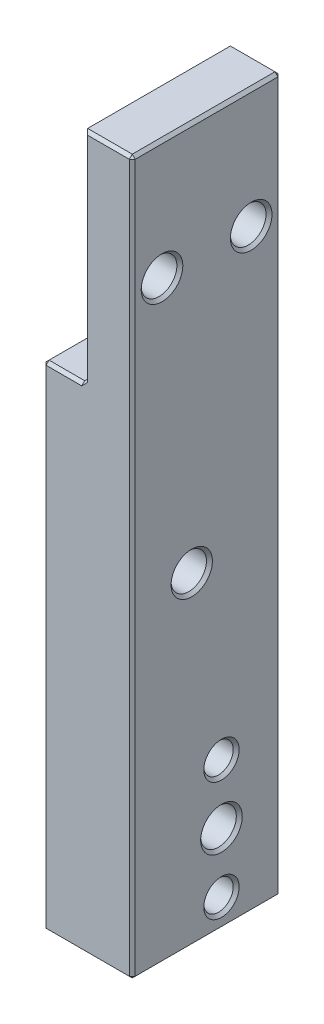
SolidWorks part; units mm, degrees
ref_plane "Plane1" through (0, 0, 0) normal (0, 0, 1) x (1, 0, 0)
ref_plane "Plane2" through (0, 0, 0) normal (0, 1, 0) x (1, 0, 0)
ref_plane "Plane3" through (0, 0, 0) normal (1, 0, 0) x (0, 0, -1)
sketch "Esquisse1" plane through (0, 0, 0) normal (0, 0, 1) x (1, 0, 0)
  line L0 (0, 0) -> (15, 0)
  line L1 (0, 0) -> (0, 83)
  line L2 (7, 83) -> (0, 83)
  line L3 (15, 40) -> (15, 0)
  line L4 (7, 83) -> (7, 120)
  line L5 (7, 120) -> (15, 120)
  line L6 (15, 120) -> (15, 40)
  dimension "D1" = 15
  dimension "D2" = 8
  dimension "D3" = 83
  dimension "D4" = 37
extrude "Base-Extrusion" add sketch "Esquisse1" along normal blind 25
sketch "Esquisse3" plane through (15, 0, 0) normal (1, 0, 0) x (0, 0, -1)
  line L0 (-25, 120) -> (0, 120) construction
  line L1 (-25, 120) -> (-25, 0) construction
  line L3 (0, 120) -> (0, 0) construction
  line L4 (-25, 0) -> (0, 0) construction
  circle A0 centre (-20, 100) radius 3
  circle A1 centre (-5, 100) radius 3
  circle A2 centre (-15, 54.5) radius 2.975
  circle A3 centre (-10, 24.8) radius 2.475
  circle A4 centre (-10, 14.8) radius 3
  circle A5 centre (-10, 4.8) radius 2.475
  dimension "D1" = 6
  dimension "D2" = 6
  dimension "D6" = 20
  dimension "D7" = 5.95
  dimension "D10" = 4.95
  dimension "D11" = 6
  dimension "D12" = 4.95
  dimension "D3" = 20
  dimension "D4" = 5
  dimension "D5" = 5
  dimension "D8" = 10
  dimension "D9" = 54.5
  dimension "D13" = 4.8
  dimension "D14" = 14.8
  dimension "D15" = 24.8
  dimension "D16" = 15
  dimension "D17" = 15
  dimension "D18" = 15
extrude "Enlèv. mat.-Extru.1" cut sketch "Esquisse3" against normal blind 25
chamfer "Chanfrein1" distance 0.5 angle 45
chamfer "Chanfrein2" distance 0.5 angle 45
